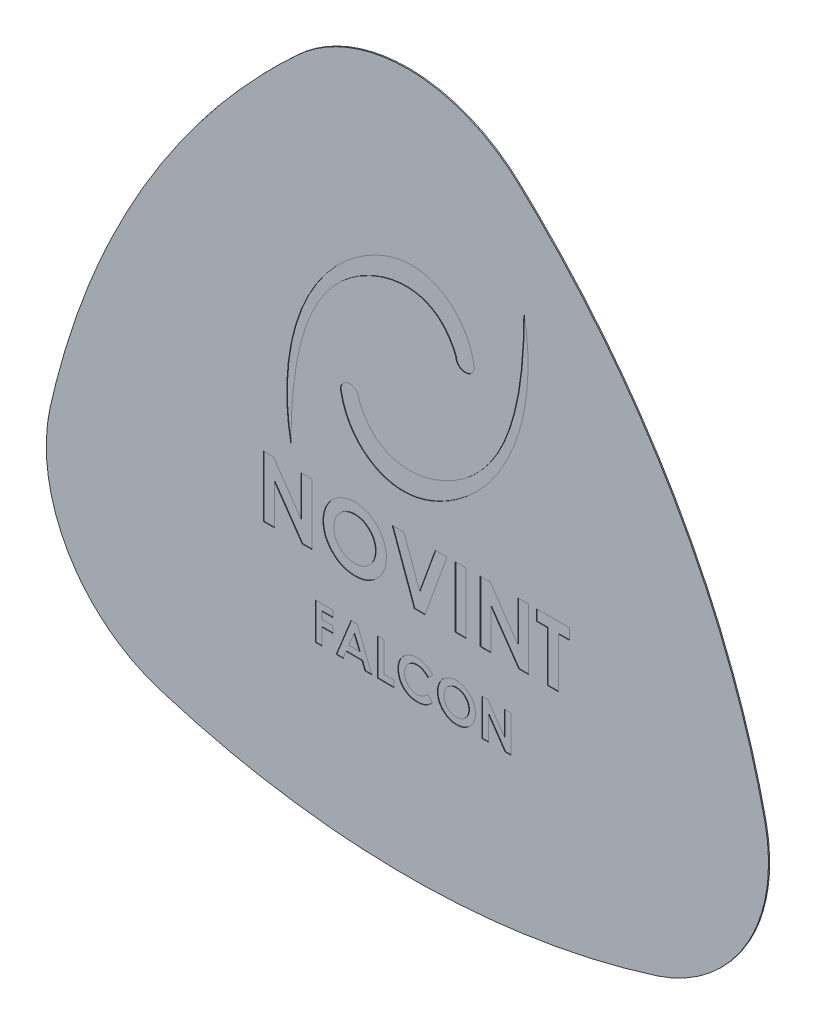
SolidWorks part; units mm, degrees
ref_plane "Plan de face" through (0, 0, 0) normal (0, 0, 1) x (1, 0, 0)
ref_plane "Plan de dessus" through (0, 0, 0) normal (0, 1, 0) x (1, 0, 0)
ref_plane "Plan de droite" through (0, 0, 0) normal (1, 0, 0) x (0, 0, -1)
sketch "Esquisse1" plane through (0, 0, 0) normal (0, 0, 1) x (1, 0, 0)
  spline S1 degree 3 number of poles 72 (0, 149.25) -> (0, 149.25)
extrude "Boss.-Extru.1" add sketch "Esquisse1" along normal blind 0.1
sketch "Esquisse2" plane through (0, 0, 0.1) normal (0, 0, 1) x (1, 0, 0)
  line L0 (-13.0847, 108.9955) -> (14.3157, 108.9955) construction
  line L1 (-8.3489, 102.1759) -> (11.1625, 102.1759) construction
  line L2 (0, 149.25) -> (0, 107.1447) construction
  arc A0 (4.1921, 129.7302) -> (5.8103, 129.7302) centre (5.0012, 129.7302) ccw
  arc A1 (-4.1921, 122.2698) -> (-5.8103, 122.2698) centre (-5.0012, 122.2698) ccw
  spline S0 degree 3 number of poles 72 (0, 149.25) -> (0, 149.25) construction
  spline S1 degree 3 poles (5.8103, 129.7302) (5.2488, 132.8748) (1.2024, 135.8625) (-9.144, 131.0676) (-11.2806, 122.0656) (-10.1022, 115.9753) knots 0 0 0 0 0.231488 0.407412 1 1 1 1
  spline S2 degree 3 poles (-10.1022, 115.9753) (-10.0825, 120.897) (-9.1558, 131.8365) (2.4226, 134.1417) (4.1921, 129.7302) knots 0 0 0 0 0.598513 1 1 1 1
  spline S3 degree 3 poles (10.1022, 136.0247) (10.0825, 131.103) (9.1558, 120.1635) (-2.4226, 117.8583) (-4.1921, 122.2698) knots 0 0 0 0 0.598513 1 1 1 1
  spline S4 degree 3 poles (-5.8103, 122.2698) (-5.2488, 119.1252) (-1.2024, 116.1375) (9.144, 120.9324) (11.2806, 129.9344) (10.1022, 136.0247) knots 0 0 0 0 0.231488 0.407412 1 1 1 1
  text T0 "<b>FALCON</b>" font "Century Gothic" height in points 12
  text T1 "<b>NOVINT</b>" font "Century Gothic" height in points 20
  point P17 (-1.3064, 127.048)
  dimension "D1" = 2
extrude "Enlèv. mat.-Extru.1" cut sketch "Esquisse2" against normal blind 0.05
